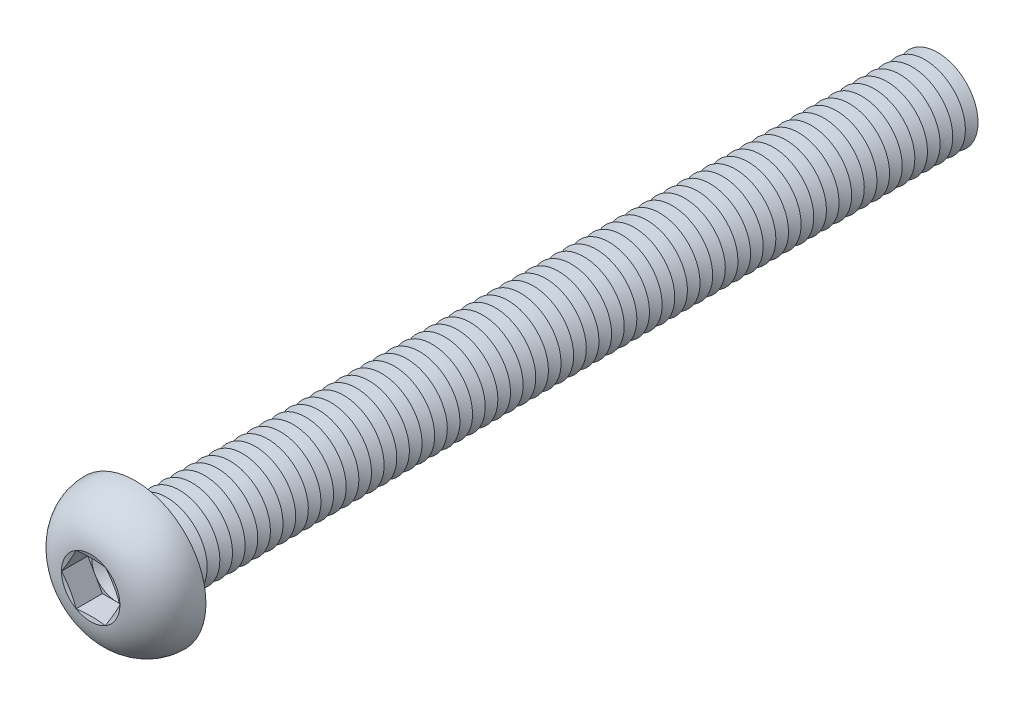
SolidWorks part; units mm, degrees
ref_plane "Front Plane" through (0, 0, 0) normal (0, 0, 1) x (1, 0, 0)
ref_plane "Top Plane" through (0, 0, 0) normal (0, 1, 0) x (1, 0, 0)
ref_plane "Right Plane" through (0, 0, 0) normal (1, 0, 0) x (0, 0, -1)
sketch "Sketch1" plane through (0, 0, 0) normal (1, 0, 0) x (0, 0, -1)
  line L0 (0, 4) -> (0, 7)
  line L3 (0, 4) -> (80, 4)
  line L4 (80, 4) -> (80, 0)
  line L5 (80, 0) -> (-4.4, 0) construction
  line L6 (-4.4, 0) -> (80, 0)
  line L7 (-4.4, 2.8867) -> (-4.4, 1.4434) construction
  line L8 (-4.4, 1.4434) -> (-4.4, 0)
  line L9 (-4.4, 2.8867) -> (-4.0132, 1.4434)
  line L10 (-4.0132, 1.4434) -> (-4.4, 1.4434)
  line L11 (80, 0) -> (22.7481, 0) construction
  line L12 (0, 7) -> (-4.4, 7) construction
  arc A1 (0, 7) -> (-4.4, 2.8867) centre (0, 2.59) ccw
  point P8 (80, 2)
  dimension "D1" = 14
  dimension "D2" = 8
  dimension "D3" = 4.4
  dimension "D4" = 5.7735
  dimension "D5" = 80
  dimension "D6" = 15
revolve "Revolve1" add sketch "Sketch1" angle 360 about L5
fillet "Fillet1" radius 0.625 1 edges at (0, 4, 0)
sketch "Sketch2" plane through (0, 0, 0) normal (1, 0, 0) x (0, 0, -1)
  line L0 (79.375, 4) -> (80.625, 4)
  line L1 (80, 4) -> (0.625, 4) construction
  line L2 (80.625, 4) -> (80, 2.9175)
  line L3 (80, -4) -> (80, 4) construction
  line L4 (80, 2.9175) -> (79.375, 4)
  dimension "D1" = 1.25
revolve "Cut-Revolve1" cut sketch "Sketch2" angle 360 about axis through (0, 0, -80) along (0, 0, -1)
pattern_linear "LPattern1" count 64 spacing 1.25 along (0, 0, 1) of "Cut-Revolve1"
sketch "Sketch3" plane through (0, 0, 4.4) normal (0, 0, 1) x (1, 0, 0)
  line L7 (1.4434, 2.5) -> (-1.4434, 2.5)
  line L8 (-1.4434, 2.5) -> (-2.8867, 0)
  line L9 (-2.8867, 0) -> (-1.4434, -2.5)
  line L10 (-1.4434, -2.5) -> (1.4434, -2.5)
  line L11 (1.4434, -2.5) -> (2.8867, 0)
  line L12 (2.8867, 0) -> (1.4434, 2.5)
  circle A0 centre (0, 0) radius 2.5 construction
  circle A3 centre (0, 0) radius 2.8867 construction
extrude "Cut-Extrude1" cut sketch "Sketch3" against normal blind 2.6
sketch "Sketch4" plane through (0, 0, 1.8) normal (0, 0, 1) x (1, 0, 0)
  line L1 (1.4434, 2.5) -> (-1.4434, 2.5) construction
  circle A0 centre (0, 0) radius 2.5
extrude "Cut-Extrude2" cut sketch "Sketch4" against normal through all draft 60
